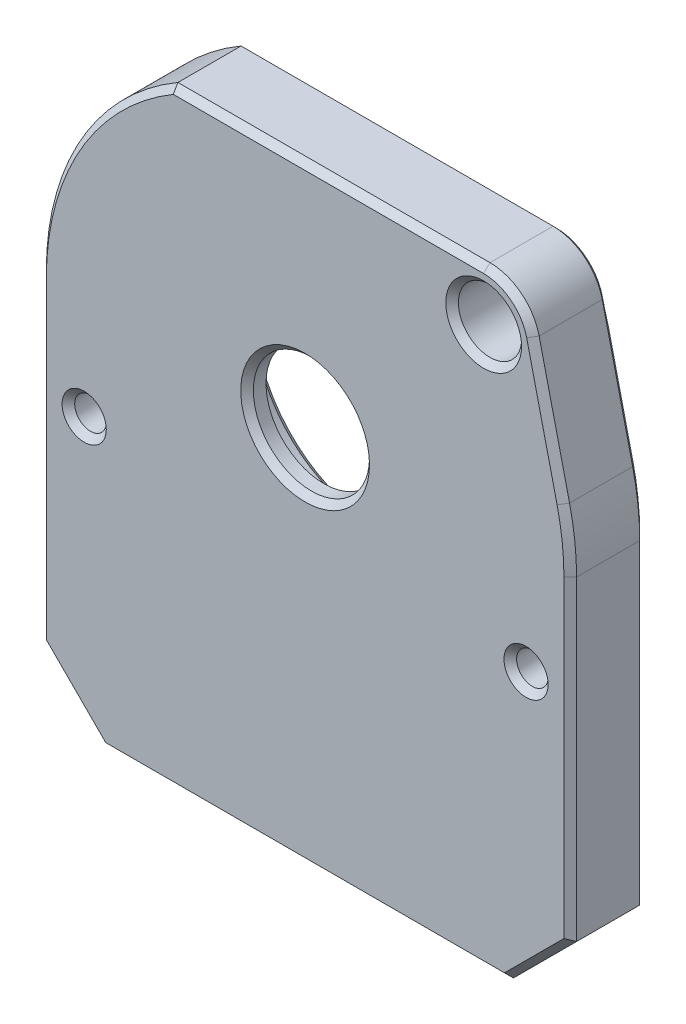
SolidWorks part; units mm, degrees
ref_plane "前视" through (0, 0, 0) normal (0, 0, 1) x (1, 0, 0)
ref_plane "上视" through (0, 0, 0) normal (0, 1, 0) x (1, 0, 0)
ref_plane "右视" through (0, 0, 0) normal (1, 0, 0) x (0, 0, -1)
sketch "草图1" plane through (0, 0, 0) normal (0, 0, 1) x (1, 0, 0)
  line L0 (0, 0) -> (0, -29.4586) construction
  line L1 (-21, 0) -> (-21, -25)
  line L2 (-16, -30) -> (16, -30)
  line L3 (21, -25) -> (21, 0)
  line L4 (0, 0) -> (22.58, 22.58) construction
  line L5 (-10.5765, 18.1421) -> (14.1421, 18.1421)
  line L6 (18.0363, 15.0563) -> (20.4442, 4.7995)
  line L7 (-21, -25) -> (-16, -30)
  line L8 (16, -30) -> (21, -25)
  circle A0 centre (0, 0) radius 4.6
  arc A1 (21, 0) -> (20.4442, 4.7995) centre (0, 0) ccw
  arc A2 (18.0363, 15.0563) -> (14.1421, 18.1421) centre (14.1421, 14.1421) ccw
  arc A3 (-10.5765, 18.1421) -> (-21, 0) centre (0, 0) ccw
  circle A4 centre (14.1421, 14.1421) radius 2.5
  circle A5 centre (-17.5, -8) radius 1.25
  circle A6 centre (17.5, -8) radius 1.25
  point P6 (-21, -30)
  point P8 (21, -30)
  dimension "D1" = 9.2
  dimension "D2" = 30
  dimension "D4" = 45
  dimension "D5" = 20
  dimension "D6" = 8
  dimension "D7" = 18.1421
  dimension "D8" = 5
  dimension "D9" = 8
  dimension "D10" = 35
  dimension "D13" = 2.5
  dimension "D3" = 42
extrude "凸台-拉伸1" add sketch "草图1" along normal blind 6
sketch "草图2" plane through (0, 0, 0) normal (0, 0, -1) x (-1, 0, 0)
  circle A0 centre (0, 0) radius 9.5
  dimension "D1" = 19
extrude "切除-拉伸1" cut sketch "草图2" against normal blind 4
sketch "草图3" plane through (0, 0, 4) normal (0, 0, -1) x (-1, 0, 0)
  circle A0 centre (0, 0) radius 8
  dimension "D1" = 16
extrude "切除-拉伸2" cut sketch "草图3" against normal blind 0.5
sketch "草图4" plane through (0, -30, 0) normal (0, -1, 0) x (1, 0, 0)
  line L0 (-21, 3) -> (21, 3) construction
  line L1 (-21, 6) -> (-21, 0) construction
  line L2 (21, 6) -> (21, 0) construction
  line L3 (0, 0) -> (0, 9.1819) construction
  circle A0 centre (-10, 3) radius 1.25
  circle A1 centre (10, 3) radius 1.25
  dimension "D1" = 2.5
  dimension "D2" = 20
extrude "切除-拉伸3" cut sketch "草图4" against normal blind 8
sketch "草图5" plane through (0, 0, 0) normal (0, 0, -1) x (-1, 0, 0)
  circle A0 centre (-14.1421, 14.1421) radius 3.5
  dimension "D1" = 7
extrude "切除-拉伸4" cut sketch "草图5" against normal blind 1
chamfer "倒角1" distance 0.5 angle 45 29 edges at (-21, -12.5, 0) (-18.5, -27.5, 0) (0, -30, 0) (18.5, -27.5, 0) (21, -12.5, 0) (20.8606, 2.4158, 0) (19.2402, 9.9279, 0) (16.6264, 17.2772, 0) (1.7828, 18.1421, 0) (-18.2086, 10.4617, 0) (-9.5, 0, 0) (16.6421, 14.1421, 6) (1.7828, 18.1421, 6) (16.6264, 17.2772, 6) (19.2402, 9.9279, 6) (20.8606, 2.4158, 6) (21, -12.5, 6) (18.5, -27.5, 6) (0, -30, 6) (-18.5, -27.5, 6) (-21, -12.5, 6) (-18.2086, 10.4617, 6) (4.6, 0, 6) (16.25, -8, 0) (-16.25, -8, 0) (16.25, -8, 6) (-16.25, -8, 6) (10.6421, 14.1421, 0) (11.6421, 14.1421, 1)
